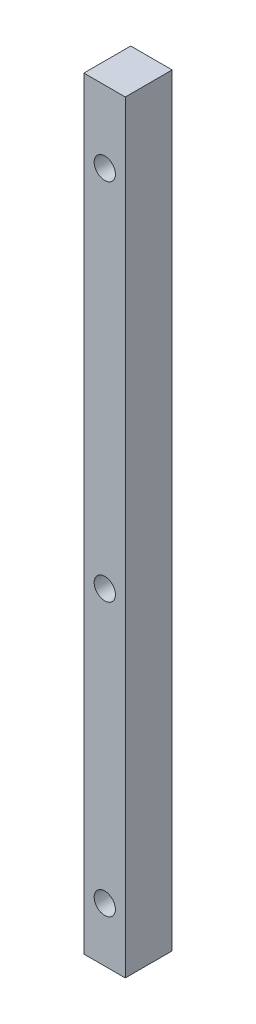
SolidWorks part; units mm, degrees
ref_plane "Front Plane" through (0, 0, 0) normal (0, 0, 1) x (1, 0, 0)
ref_plane "Top Plane" through (0, 0, 0) normal (0, 1, 0) x (1, 0, 0)
ref_plane "Right Plane" through (0, 0, 0) normal (1, 0, 0) x (0, 0, -1)
sketch "Sketch1" plane through (0, 0, 0) normal (0, 0, 1) x (1, 0, 0)
  line L1 (0, 0) -> (9.652, 0)
  line L2 (0, 0) -> (0, -177.8)
  line L3 (0, -177.8) -> (9.652, -177.8)
  line L4 (9.652, 0) -> (9.652, -177.8)
  circle A1 centre (4.8768, -101.6) radius 2.4765
  circle A2 centre (4.8768, -165.1) radius 2.4765
  circle A4 centre (4.8768, -16.764) radius 2.4765
  point P5 (4.826, 0)
  point P7 (4.826, -177.8)
  point P17 (5.1527, -171.1522)
  point P18 (0, 0)
  point P19 (7.8994, -171.5405)
  point P20 (4.8396, -170.494)
  point P21 (4.8396, -88.9)
  point P22 (4.8396, -29.77)
  dimension "D3" = 4.953
  dimension "D4" = 4.953
  dimension "D5" = 16.764
  dimension "D6" = 4.953
  dimension "D9" = 4.7752
  dimension "D1" = 9.652
  dimension "D2" = 177.8
  dimension "D7" = 12.7
  dimension "D8" = 76.2
  dimension "D10" = 4.7752
  dimension "D11" = 4.7752
extrude "Boss-Extrude1" add sketch "Sketch1" along normal blind 10.922
